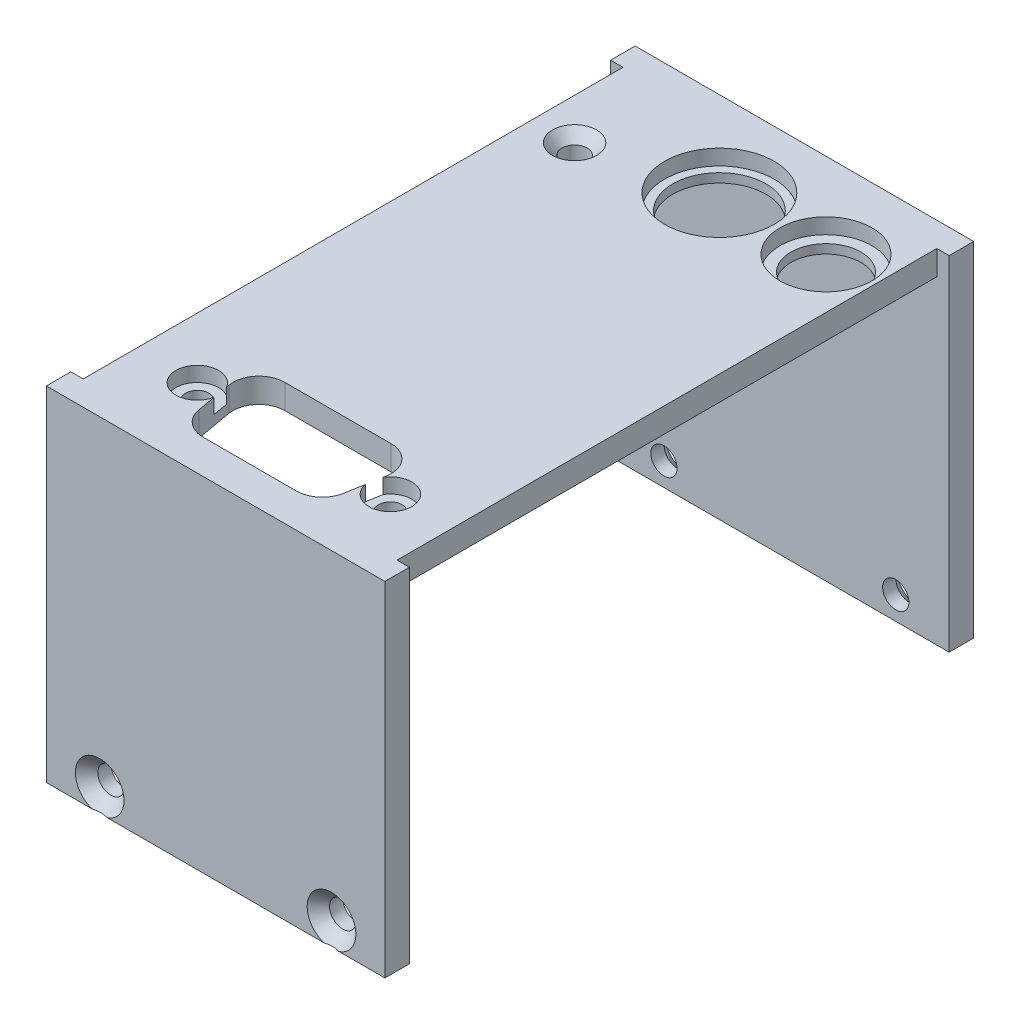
SolidWorks part; units mm, degrees
ref_plane "Front" through (0, 0, 0) normal (0, 0, 1) x (1, 0, 0)
ref_plane "Top" through (0, 0, 0) normal (0, 1, 0) x (1, 0, 0)
ref_plane "Right" through (0, 0, 0) normal (1, 0, 0) x (0, 0, -1)
sketch "Sketch1" plane through (0, 0, 0) normal (1, 0, 0) x (0, 0, -1)
  line L0 (-38.1, 0) -> (38.1, 0)
  line L1 (38.1, 0) -> (38.1, -50.8)
  line L2 (38.1, -50.8) -> (34.925, -50.8)
  line L3 (34.925, -50.8) -> (34.925, -3.175)
  line L4 (34.925, -3.175) -> (-34.925, -3.175)
  line L5 (-34.925, -3.175) -> (-34.925, -50.8)
  line L6 (-34.925, -50.8) -> (-38.1, -50.8)
  line L7 (-38.1, -50.8) -> (-38.1, 0)
  point P4 (0, 0)
  point P10 (38.1, -47.625)
  point P11 (-38.1, -47.625)
  dimension "D1" = 76.2
  dimension "D2" = 69.85
  dimension "D3" = 50.8
  dimension "D4" = 3.175
  dimension "D5" = 3.175
extrude "3218C63" add sketch "Sketch1" along normal mid plane 43.815
sketch "Sketch10" plane through (0, 0, 0) normal (1, 0, 0) x (0, 0, -1)
  line L0 (38.1, 0) -> (-38.1, 0) construction
  line L1 (-46.8158, -44.45) -> (45.1104, -44.45)
  line L2 (-46.8158, -44.45) -> (-46.8158, -58.9972)
  line L3 (-46.8158, -58.9972) -> (45.1104, -58.9972)
  line L4 (45.1104, -44.45) -> (45.1104, -58.9972)
  dimension "D1" = 44.45
extrude "Extrude8" cut sketch "Sketch10" against normal through all and the other way through all
sketch "Sketch2" plane through (0, 0, 0) normal (0, 1, 0) x (1, 0, 0)
  line L0 (21.9075, 34.925) -> (-21.9075, 34.925) construction
  line L1 (20.3075, 34.925) -> (28.4056, 34.925)
  line L2 (20.3075, 34.925) -> (20.3075, -34.925)
  line L3 (20.3075, -34.925) -> (28.4056, -34.925)
  line L4 (28.4056, 34.925) -> (28.4056, -34.925)
  line L5 (21.9075, -34.925) -> (-21.9075, -34.925) construction
  line L6 (-20.3075, 34.925) -> (-31.3024, 34.925)
  line L7 (-20.3075, 34.925) -> (-20.3075, -34.925)
  line L8 (-20.3075, -34.925) -> (-31.3024, -34.925)
  line L9 (-31.3024, 34.925) -> (-31.3024, -34.925)
  line L10 (21.9075, 38.1) -> (21.9075, -38.1) construction
  line L11 (-21.9075, 38.1) -> (-21.9075, -38.1) construction
  dimension "D1" = 1.6
  dimension "D2" = 1.6
extrude "Extrude2" cut sketch "Sketch2" against normal up to surface (3.175 mm away)
hole_wizard "CSK for M3 Flat Head Machine Screw1" positions "Sketch4" profile "Sketch3" countersink size "M3" standard "Ansi Metric"
sketch "Sketch4" plane through (0, 0, -38.1) normal (0, 0, -1) x (-1, 0, 0)
  line L1 (-21.9075, -44.45) -> (21.9075, -44.45) construction
  point P0 (-15, -41.4528)
  point P1 (15, -41.4528)
  dimension "D1" = 2.9972
  dimension "D2" = 15
  dimension "D3" = 30
sketch "Sketch3" plane through (15, -41.4528, -38.1) normal (1, 0, 0) x (0, 1, 0)
  line L0 (0, 0) -> (0, 76.2)
  line L1 (0, 76.2) -> (1.7, 76.2)
  line L2 (1.7, 76.2) -> (1.7, 1.45)
  line L3 (1.7, 1.45) -> (3.15, 0)
  line L5 (3.15, 0) -> (0, 0)
  line L6 (-1.7, 1.45) -> (-3.15, 0) construction
  line L11 (0, -6.35) -> (0, 107.95) construction
  dimension "Thru Hole Dia." = 3.4
  dimension "Thru Hole Depth" = 76.2
  dimension "Near C'Sink Dia." = 6.3
  dimension "Near C'Sink Angle" = 90
sketch "Sketch5" plane through (0, 0, 0) normal (0, 1, 0) x (1, 0, 0)
  line L0 (21.9075, -38.1) -> (-21.9075, -38.1) construction
  line L2 (-21.9075, 38.1) -> (-21.9075, 34.925) construction
  circle A0 centre (0, 27.1) radius 6.0325
  circle A1 centre (13.7925, 27.1) radius 4.5339
  dimension "D1" = 12.065
  dimension "D2" = 9.0678
  dimension "D3" = 65.2
  dimension "D4" = 35.7
extrude "Extrude3" cut sketch "Sketch5" against normal up to next
sketch "Sketch6" plane through (0, 0, 0) normal (0, 1, 0) x (1, 0, 0)
  circle A0 centre (0, 27.1) radius 7.0866
  circle A1 centre (13.7925, 27.1) radius 5.9531
  dimension "D1" = 14.1732
  dimension "D2" = 11.9062
extrude "Extrude4" cut sketch "Sketch6" against normal blind 2.0066
sketch "Sketch7" plane through (0, 0, 0) normal (0, 1, 0) x (1, 0, 0)
  line L0 (-6.8834, -22.2619) -> (6.8834, -22.2619)
  line L1 (10.1853, -26.197) -> (9.3522, -30.9214)
  line L2 (6.0504, -33.6919) -> (-6.0504, -33.6919)
  line L3 (-9.3522, -30.9214) -> (-10.1853, -26.197)
  line L6 (0, -33.6919) -> (0, -17.4898) construction
  line L8 (21.9075, -38.1) -> (-21.9075, -38.1) construction
  arc A0 (-6.0504, -33.6919) -> (-9.3522, -30.9214) centre (-6.0504, -30.3391) cw
  arc A1 (-6.8834, -22.2619) -> (-10.1853, -26.197) centre (-6.8834, -25.6147) ccw
  arc A2 (6.8834, -22.2619) -> (10.1853, -26.197) centre (6.8834, -25.6147) cw
  arc A3 (9.3522, -30.9214) -> (6.0504, -33.6919) centre (6.0504, -30.3391) cw
  circle A4 centre (12.4968, -27.9769) radius 1.524
  circle A5 centre (-12.4968, -27.9769) radius 1.524
  point P6 (0, -22.2619)
  point P12 (-10.8791, -22.2619)
  point P15 (10.8791, -22.2619)
  dimension "D5" = 3.3528
  dimension "D7" = 24.9936
  dimension "D8" = 3.048
  dimension "D12" = 5.715
  dimension "D1" = 21.7582
  dimension "D2" = 10
  dimension "D3" = 10
  dimension "D4" = 11.43
  dimension "D6" = 12.4968
  dimension "D9" = 5.715
  dimension "D10" = 15.8381
  dimension "D11" = 20.3705
  dimension "D13" = 13.7668
  dimension "D14" = 12.1007
  dimension "D15" = 6.0504
  dimension "D16" = 5.715
extrude "DB9 Feature" cut sketch "Sketch7" against normal up to next
sketch "Sketch9" plane through (0, 0, 0) normal (0, 1, 0) x (1, 0, 0)
  circle A0 centre (12.4968, -27.9769) radius 2.7686
  circle A1 centre (-12.4968, -27.9769) radius 2.7686
  dimension "D1" = 5.5372
extrude "Extrude7" cut sketch "Sketch9" against normal blind 1.9304
mirror "Mirror1" about plane through (0, 0, 0) normal (0, 0, 1) of "CSK for M3 Flat Head Machine Screw1"
hole_wizard "CSK for #4 Flat Head Machine Screw1" positions "Sketch13" profile "Sketch12" countersink size "#4" standard "ANSI Inch"
sketch "Sketch13" plane through (0, 0, 0) normal (0, 1, 0) x (1, 0, 0)
  line L0 (21.9075, 38.1) -> (-21.9075, 38.1) construction
  point P0 (-14.986, 23.3473)
  dimension "D1" = 14.7527
  dimension "D2" = 14.986
sketch "Sketch12" plane through (-14.986, 0, -23.3473) normal (1, 0, 0) x (0, 0, 1)
  line L0 (0, 0) -> (0, 44.45)
  line L1 (0, 44.45) -> (1.6319, 44.45)
  line L2 (1.6319, 44.45) -> (1.6319, 1.4098)
  line L3 (1.6319, 1.4098) -> (2.8575, 0)
  line L5 (2.8575, 0) -> (0, 0)
  line L6 (-1.6319, 1.4098) -> (-2.8575, 0) construction
  line L11 (0, -6.35) -> (0, 107.95) construction
  dimension "Thru Hole Dia." = 3.2639
  dimension "Thru Hole Depth" = 44.45
  dimension "Near C'Sink Dia." = 5.715
  dimension "Near C'Sink Angle" = 82
